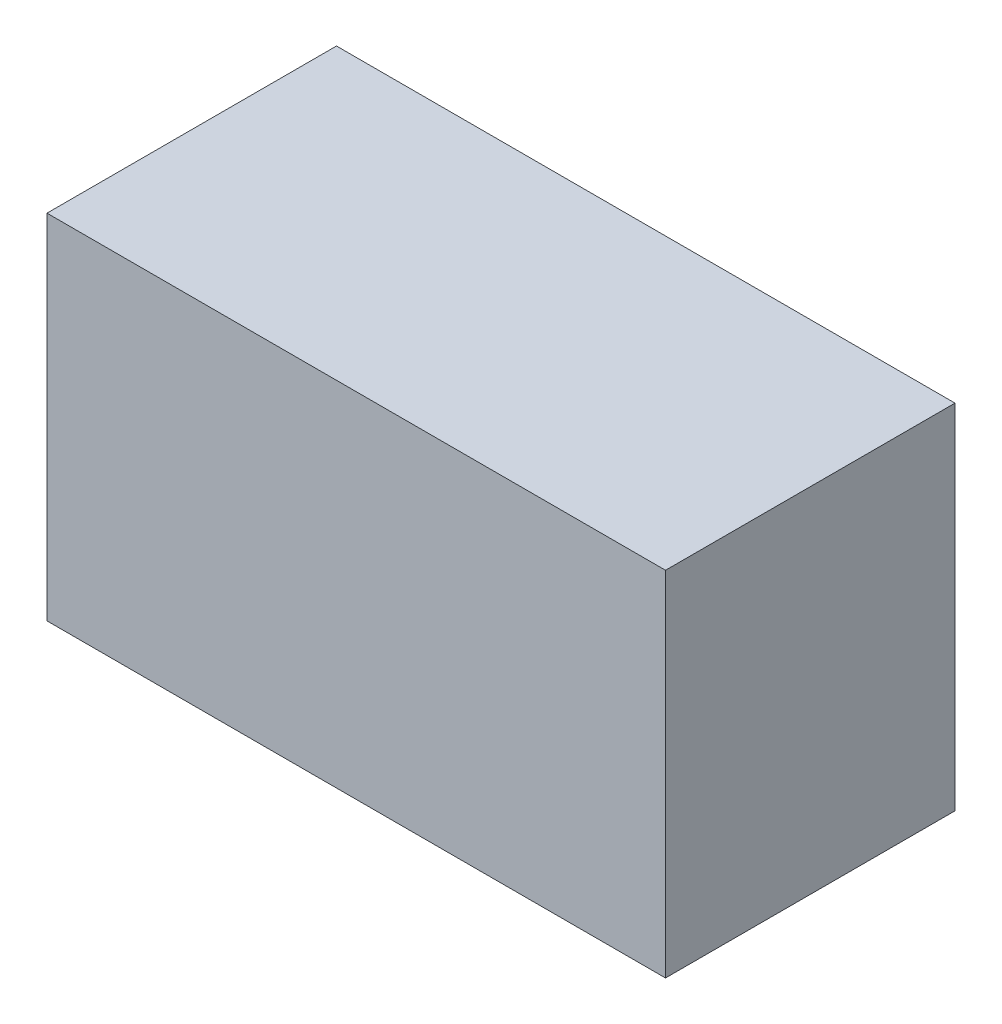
SolidWorks part; units mm, degrees
ref_plane "Front Plane" through (0, 0, 0) normal (0, 0, 1) x (1, 0, 0)
ref_plane "Top Plane" through (0, 0, 0) normal (0, 1, 0) x (1, 0, 0)
ref_plane "Right Plane" through (0, 0, 0) normal (1, 0, 0) x (0, 0, -1)
sketch "Sketch1" plane through (0, 0, 0) normal (0, 0, 1) x (1, 0, 0)
  line L1 (-67.5596, 33.2324) -> (39.2662, 33.2324)
  line L2 (-67.5596, 33.2324) -> (-67.5596, -27.7553)
  line L3 (-67.5596, -27.7553) -> (39.2662, -27.7553)
  line L4 (39.2662, 33.2324) -> (39.2662, -27.7553)
surface "Surface-Extrude1" sketch "Sketch1" parameters "D1"=50
surface "Surface-Plane1"
